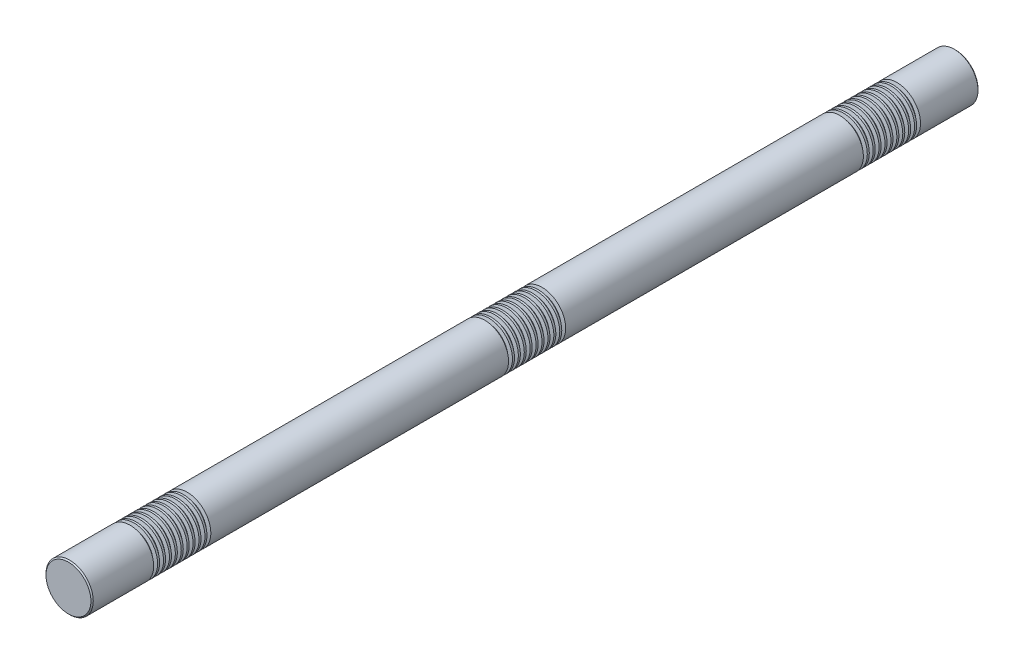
SolidWorks part; units mm, degrees
ref_plane "Front Plane" through (0, 0, 0) normal (0, 0, 1) x (1, 0, 0)
ref_plane "Top Plane" through (0, 0, 0) normal (0, 1, 0) x (1, 0, 0)
ref_plane "Right Plane" through (0, 0, 0) normal (1, 0, 0) x (0, 0, -1)
sketch "Sketch1" plane through (0, 0, 0) normal (0, 0, 1) x (1, 0, 0)
  circle A0 centre (0, 0) radius 40
  dimension "D1" = 80
extrude "Boss-Extrude1" add sketch "Sketch1" along normal mid plane 1500
chamfer "Chamfer1" distance 2 angle 45 2 edges at (40, 0, -750) (40, 0, 750)
sketch "Sketch2" plane through (0, 0, 0) normal (1, 0, 0) x (0, 0, -1)
  line L0 (650.8038, 40) -> (644.1962, 40)
  line L1 (748, 40) -> (-748, 40) construction
  line L2 (644.1962, 40) -> (645.8038, 34)
  line L3 (645.8038, 34) -> (649.1962, 34)
  line L4 (649.1962, 34) -> (650.8038, 40)
  line L5 (750, -38) -> (750, 38) construction
  point P4 (647.5, 40)
  point P7 (647.5, 34)
  point P8 (650, 37)
  point P9 (645, 37)
  dimension "D1" = 5
  dimension "D2" = 100
  dimension "D3" = 6
  dimension "D4" = 30
revolve "Cut-Revolve1" cut sketch "Sketch2" angle 360 about axis through (0, 0, 750) along (0, 0, -1)
pattern_linear "LPattern1" count 10 spacing 10 along (0, 0, 1) of "Cut-Revolve1"
pattern_linear "LPattern2" count 3 spacing 600 along (0, 0, 1) of "Cut-Revolve1", "LPattern1"
